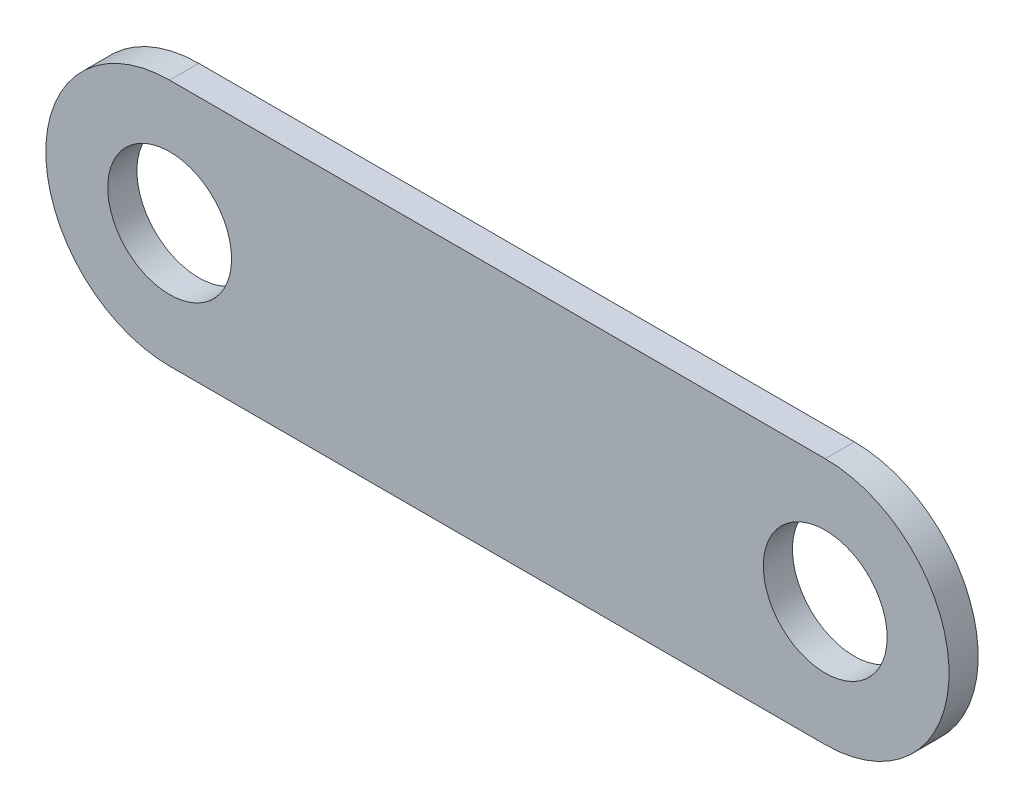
SolidWorks part; units mm, degrees
ref_plane "Front Plane" through (0, 0, 0) normal (0, 0, 1) x (1, 0, 0)
ref_plane "Top Plane" through (0, 0, 0) normal (0, 1, 0) x (1, 0, 0)
ref_plane "Right Plane" through (0, 0, 0) normal (1, 0, 0) x (0, 0, -1)
sketch "Sketch1" plane through (0, 0, 0) normal (0, 0, 1) x (1, 0, 0)
  line L0 (0, 0) -> (45, 0) construction
  line L1 (0, 8.5) -> (45, 8.5)
  line L2 (0, -8.5) -> (45, -8.5)
  arc A0 (0, 8.5) -> (0, -8.5) centre (0, 0) ccw
  arc A1 (45, -8.5) -> (45, 8.5) centre (45, 0) ccw
  circle A2 centre (0, 0) radius 4.25
  circle A3 centre (45, 0) radius 4.25
  point P3 (22.5, 0)
  dimension "D1" = 8.5
  dimension "D2" = 8.5
  dimension "D4" = 17
  dimension "D3" = 45
extrude "Boss-Extrude1" add sketch "Sketch1" against normal blind 2
